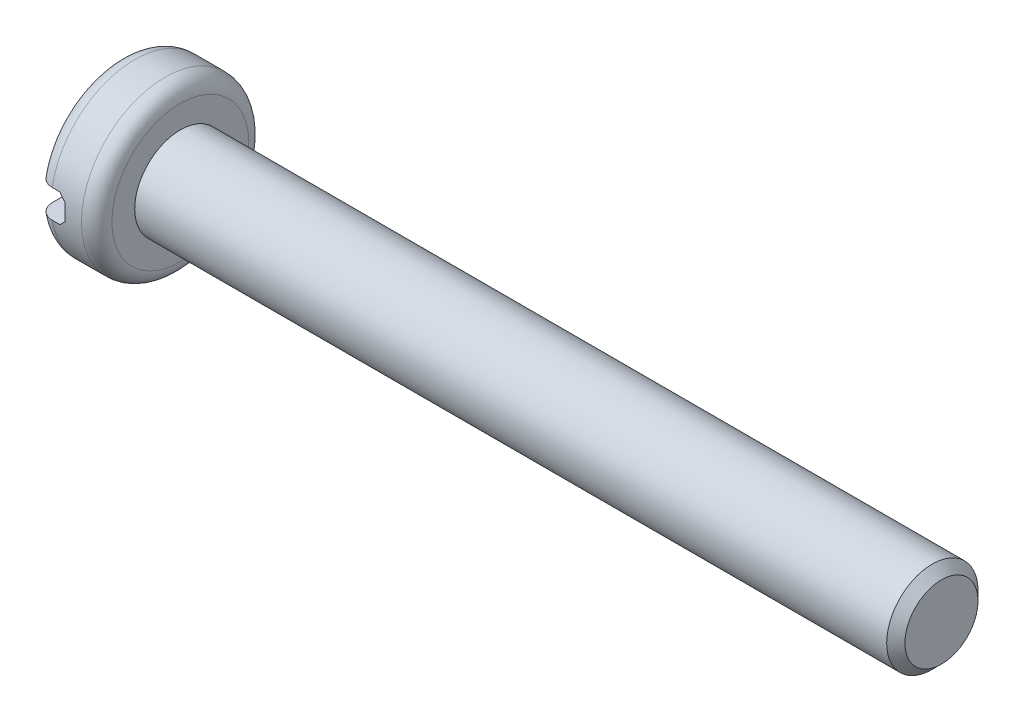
SolidWorks part; units mm, degrees
ref_plane "Face" through (0, 0, 0) normal (0, 0, 1) x (1, 0, 0)
ref_plane "Dessus" through (0, 0, 0) normal (0, 1, 0) x (1, 0, 0)
ref_plane "Droite" through (0, 0, 0) normal (1, 0, 0) x (0, 0, -1)
sketch "Esquisse1" plane through (0, 0, 0) normal (0, 0, 1) x (1, 0, 0)
  line L0 (0, 0) -> (0, 2.75)
  line L1 (0.2, 2.75) -> (2, 2.75)
  line L2 (2, 2.75) -> (2, 0)
  line L5 (0, 0) -> (7.6423, 0) construction
  line L7 (0, 2.75) -> (0.2, 2.75)
  line L8 (0, 0) -> (2, 0)
  point P1 (0, 2.75)
  dimension "D1" = 2.75
  dimension "D3" = 2
revolve "Révolution1" add sketch "Esquisse1" angle 360 about L5
sketch "Esquisse2" plane through (0, 0, 0) normal (0, 0, 1) x (1, 0, 0)
  line L0 (0, 2.75) -> (0, -2.75) construction
  line L1 (0, 0.4655) -> (0.7534, 0.4655)
  line L2 (0, 0.4655) -> (0, -0.4655)
  line L3 (0, -0.4655) -> (0.7534, -0.4655)
  line L4 (0.9534, 0.2655) -> (0.9534, -0.2655)
  line L5 (0.7534, 0.4655) -> (0.9534, 0.2655)
  line L6 (0.7534, -0.4655) -> (0.9534, -0.2655)
  point P1 (0.9534, -0.4655)
  point P3 (0.9534, 0.4655)
extrude "Enlèv. mat.-Extru.1" cut sketch "Esquisse2" against normal mid plane 10
sketch "Esquisse3" plane through (2, 0, 0) normal (1, 0, 0) x (0, 0, -1)
  circle A0 centre (0, 0) radius 1.5
  dimension "D1" = 3
extrude "Extrusion1" add sketch "Esquisse3" along normal blind 25
chamfer "Chanfrein1" distance 0.3 angle 45 1 edges at (27, 0, -1.5)
fillet "Congé1" radius 0.5 3 edges at (2, 0, 2.75) (0, -2.75, 0) (0, 2.75, 0)
